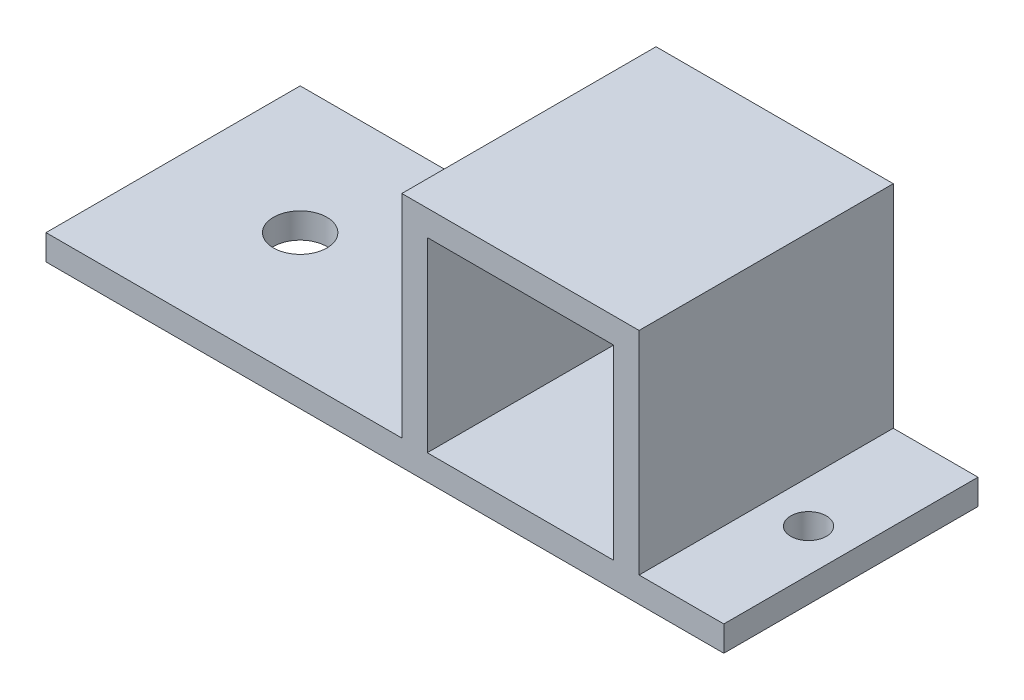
SolidWorks part; units mm, degrees
ref_plane "Front Plane" through (0, 0, 0) normal (0, 0, 1) x (1, 0, 0)
ref_plane "Top Plane" through (0, 0, 0) normal (0, 1, 0) x (1, 0, 0)
ref_plane "Right Plane" through (0, 0, 0) normal (1, 0, 0) x (0, 0, -1)
sketch "Sketch3" plane through (0, 0, 0) normal (0, 0, 1) x (1, 0, 0)
  line L1 (-40, 1.5) -> (40, 1.5)
  line L2 (-40, 1.5) -> (-40, -1.5)
  line L3 (-40, -1.5) -> (40, -1.5)
  line L4 (40, 1.5) -> (40, -1.5)
  line L5 (-40, 1.5) -> (40, -1.5) construction
  line L6 (-40, -1.5) -> (40, 1.5) construction
  point P0 (0, 0)
  dimension "D1" = 80
  dimension "D2" = 3
extrude "Boss-Extrude1" add sketch "Sketch3" along normal mid plane 30
sketch "Sketch4" plane through (0, 1.5, 0) normal (0, 1, 0) x (1, 0, 0)
  line L0 (40, -15) -> (-40, -15) construction
  line L1 (2, 15) -> (30, 15)
  line L2 (2, 15) -> (2, -15)
  line L3 (2, -15) -> (30, -15)
  line L4 (30, 15) -> (30, -15)
  line L5 (2, 15) -> (30, -15) construction
  line L6 (2, -15) -> (30, 15) construction
  line L8 (40, -15) -> (40, 15) construction
  point P0 (16, 0)
  point P7 (0, 0)
  dimension "D1" = 28
  dimension "D2" = 10
extrude "Boss-Extrude2" add sketch "Sketch4" along normal blind 25
sketch "Sketch5" plane through (0, 0, 15) normal (0, 0, 1) x (1, 0, 0)
  line L0 (2, 26.5) -> (2, 1.5) construction
  line L1 (5, 23.5) -> (27, 23.5)
  line L2 (5, 23.5) -> (5, 1.5)
  line L3 (5, 1.5) -> (27, 1.5)
  line L4 (27, 23.5) -> (27, 1.5)
  line L5 (2, 26.5) -> (30, 26.5) construction
  line L6 (30, 26.5) -> (30, 1.5) construction
  line L7 (-40, -1.5) -> (40, -1.5) construction
  dimension "D1" = 3
  dimension "D2" = 3
  dimension "D3" = 3
  dimension "D4" = 3
extrude "Cut-Extrude1" cut sketch "Sketch5" against normal through all
sketch "Sketch6" plane through (0, 1.5, 0) normal (0, 1, 0) x (1, 0, 0)
  line L0 (-15.4, 0) -> (15.4, 0) construction
  line L1 (40, -15) -> (40, 15) construction
  circle A0 centre (35, 0) radius 2.1
  point P4 (0, 0)
  dimension "D1" = 4.2
  dimension "D2" = 5
extrude "Cut-Extrude2" cut sketch "Sketch6" against normal through all
sketch "Sketch7" plane through (0, 1.5, 0) normal (0, 1, 0) x (1, 0, 0)
  line L0 (-15.4, 0) -> (15.4, 0) construction
  circle A0 centre (-25, 0) radius 3.15
  circle A1 centre (35, 0) radius 2.1 construction
  dimension "D1" = 6.3
  dimension "D2" = 60
extrude "Cut-Extrude3" cut sketch "Sketch7" against normal through all
